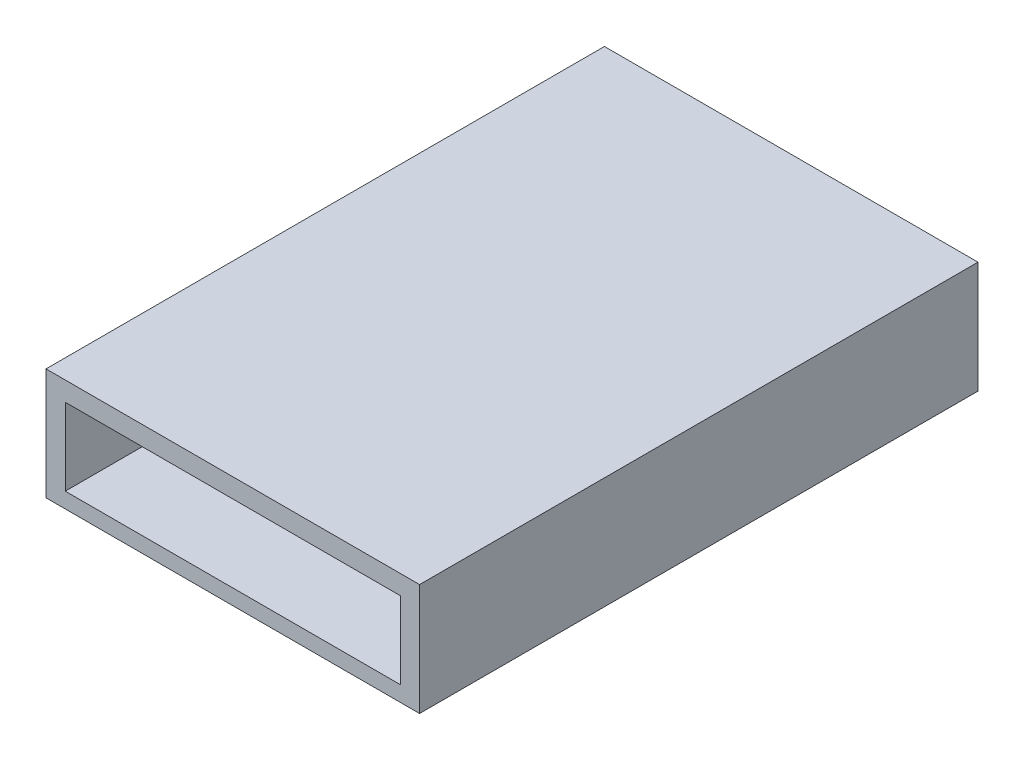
SolidWorks part; units mm, degrees
ref_plane "Front Plane" through (0, 0, 0) normal (0, 0, 1) x (1, 0, 0)
ref_plane "Top Plane" through (0, 0, 0) normal (0, 1, 0) x (1, 0, 0)
ref_plane "Right Plane" through (0, 0, 0) normal (1, 0, 0) x (0, 0, -1)
sketch "Sketch1" plane through (0, 0, 0) normal (0, 0, 1) x (1, 0, 0)
  line L1 (0, 0) -> (19.4, 0)
  line L2 (0, 0) -> (0, 5.8)
  line L3 (0, 5.8) -> (19.4, 5.8)
  line L4 (19.4, 0) -> (19.4, 5.8)
  dimension "D1" = 5.8
  dimension "D2" = 19.4
extrude "Boss-Extrude1" add sketch "Sketch1" along normal blind 29
sketch "Sketch2" plane through (0, 0, 29) normal (0, 0, 1) x (1, 0, 0)
  line L0 (19.4, 5.8) -> (0, 5.8) construction
  line L1 (1, 4.8) -> (18.4, 4.8)
  line L2 (1, 4.8) -> (1, 0.8)
  line L3 (1, 0.8) -> (18.4, 0.8)
  line L4 (18.4, 4.8) -> (18.4, 0.8)
  line L5 (0, 0) -> (19.4, 0) construction
  line L6 (0, 5.8) -> (0, 0) construction
  line L7 (19.4, 0) -> (19.4, 5.8) construction
  dimension "D1" = 1
  dimension "D2" = 0.8
  dimension "D3" = 1
  dimension "D4" = 1
extrude "Cut-Extrude1" cut sketch "Sketch2" against normal blind 28
sketch "Sketch4" plane through (0, 0, 0) normal (0, -1, 0) x (1, 0, 0)
  line L3 (19.4, 29) -> (19.4, 0) construction
  line L5 (0, 0) -> (19.4, 0) construction
  circle A0 centre (15.375, 22.765) radius 2.425
  circle A1 centre (7.405, 6.825) radius 2.425
  dimension "D1" = 4.85
  dimension "D2" = 1.6
  dimension "D3" = 4.4
  dimension "D4" = 7.97
  dimension "D5" = 15.94
extrude "Cut-Extrude3" cut sketch "Sketch4" against normal blind 0.8
sketch "Sketch3" plane through (0, 0, 1) normal (0, 0, 1) x (1, 0, 0)
  line L0 (5.7, 4.7) -> (13.7, 4.7)
  line L1 (13.7, 4.7) -> (13.7, 3.3)
  line L2 (13.7, 3.3) -> (12.5, 1.9)
  line L3 (12.5, 1.9) -> (6.9, 1.9)
  line L4 (5.7, 4.7) -> (5.7, 3.3)
  line L5 (5.7, 3.3) -> (6.9, 1.9)
  line L6 (1, 4.8) -> (1, 0.8) construction
  line L11 (18.4, 4.8) -> (1, 4.8) construction
  point P2 (9.7, 1.9)
  point P7 (9.7, 4.7)
  dimension "D1" = 8
  dimension "D2" = 5.6
  dimension "D3" = 1.4
  dimension "D4" = 2.8
  dimension "D5" = 4.7
  dimension "D7" = 0.1
extrude "Cut-Extrude2" cut sketch "Sketch3" against normal blind 28
